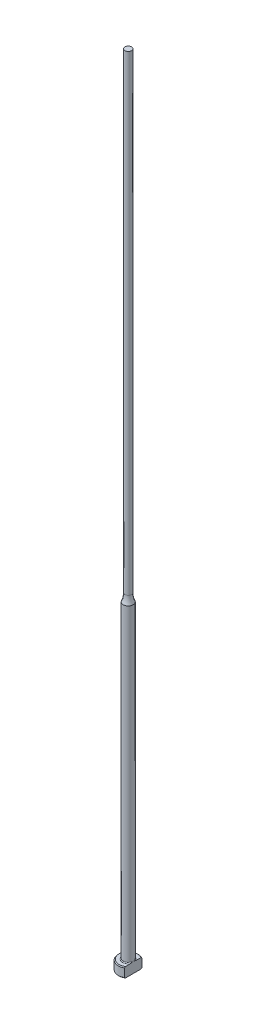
SolidWorks part; units mm, degrees
ref_plane "Front Plane" through (0, 0, 0) normal (0, 0, 1) x (1, 0, 0)
ref_plane "Top Plane" through (0, 0, 0) normal (0, 1, 0) x (1, 0, 0)
ref_plane "Right Plane" through (0, 0, 0) normal (1, 0, 0) x (0, 0, -1)
sketch "Sketch1" plane through (0, 0, 0) normal (0, 0, 1) x (1, 0, 0)
  line L0 (0, 259.9588) -> (0, -15.1925) construction
  line L1 (0, 0) -> (-3.175, 0)
  line L2 (-3.175, 0) -> (-3.175, 3.175)
  line L3 (-3.175, 3.175) -> (-1.5875, 3.175)
  line L4 (-1.0554, 104.1446) -> (-1.0554, 254)
  line L5 (-1.0554, 254) -> (0, 254)
  line L6 (0, 254) -> (0, 0)
  line L7 (-1.5875, 3.175) -> (-1.5875, 101.6)
  arc A0 (-1.5875, 101.6) -> (-1.0554, 104.1446) centre (-7.4054, 104.1446) ccw
  point P13 (-1.5875, 0)
  dimension "D1" = 6.35
  dimension "L" = 254
  dimension "D2" = 3.175
  dimension "H" = 6.35
  dimension "T" = 3.175
  dimension "D" = 2.1107
  dimension "S" = 101.6
revolve "Revolve1" add sketch "Sketch1" angle 360 about L0
chamfer "Chamfer1" distance 0.254 angle 45 2 edges at (0, 3.175, 3.175) (0, 0, 3.175)
fillet "Fillet1" radius 0.254 1 edges at (0, 3.175, 1.5875)
sketch "Sketch2" plane through (0, 0, 0) normal (0, 1, 0) x (1, 0, 0)
  line L0 (1.5875, -2.7496) -> (1.5875, 2.7496)
  circle A0 centre (0, 0) radius 3.175 construction
  arc A2 (1.5875, -2.7496) -> (1.5875, 2.7496) centre (0, 0) ccw
  circle A3 centre (0, 0) radius 3.175 construction
  circle A4 centre (0, 0) radius 1.5875 construction
extrude "Key Head" cut sketch "Sketch2" along normal up to next
